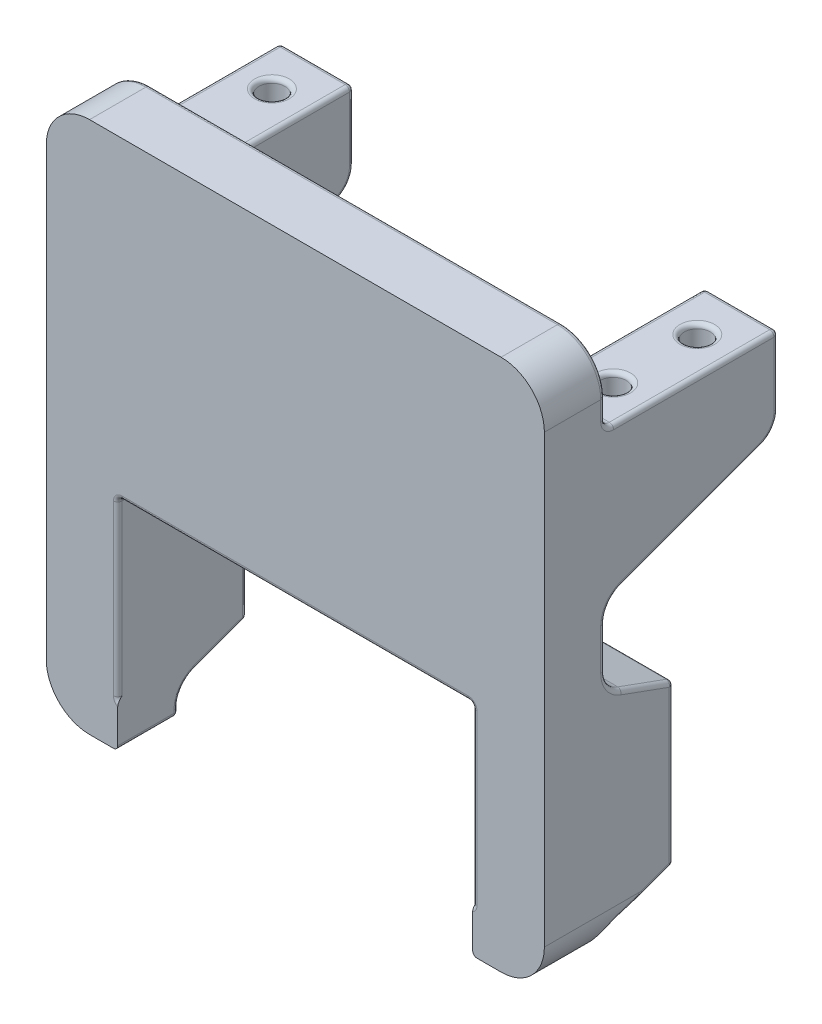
SolidWorks part; units mm, degrees
ref_plane "Front Plane" through (0, 0, 0) normal (0, 0, 1) x (1, 0, 0)
ref_plane "Top Plane" through (0, 0, 0) normal (0, 1, 0) x (1, 0, 0)
ref_plane "Right Plane" through (0, 0, 0) normal (1, 0, 0) x (0, 0, -1)
sketch "Sketch1" plane through (0, 0, 0) normal (0, 0, 1) x (1, 0, 0)
  line L0 (27.25, 20.95) -> (27.25, 16.3938) construction
  line L1 (27.25, 16.3938) -> (-27.25, 16.3938) construction
  line L2 (-27.25, 16.3938) -> (-27.25, 20.95) construction
  line L4 (28.75, 29) -> (-28.75, 29)
  line L5 (28.75, 29) -> (28.75, -32.4715)
  line L6 (28.75, -32.4715) -> (-28.75, -32.4715)
  line L7 (-28.75, 29) -> (-28.75, -32.4715)
  line L8 (-19.75, -27.4715) -> (19.75, -27.4715) construction
  line L9 (20.2215, -27) -> (20.2215, -8) construction
  line L10 (20.4715, -27.7215) -> (-20.5, -27.7215)
  line L11 (20.4715, -27.7215) -> (20.4715, -7.25)
  line L12 (20.4715, -7.25) -> (-20.5, -7.25)
  line L13 (-20.5, -27.7215) -> (-20.5, -7.25)
  line L15 (-19.75, -7.5) -> (19.75, -7.5) construction
  line L16 (-20.25, -27) -> (-20.25, -8) construction
  line L17 (-19.5, 29) -> (7.2839, 29) construction
  line L18 (-27.25, -11.275) -> (-27.25, -9.85) construction
  line L19 (27.25, -14.025) -> (27.25, -20.975) construction
  dimension "D1" = 5
  dimension "D2" = 0.25
  dimension "D3" = 0.25
  dimension "D4" = 0.25
  dimension "D5" = 0.25
  dimension "D6" = 1.5
  dimension "D7" = 1.5
extrude "Boss-Extrude1" add sketch "Sketch1" along normal blind 7
fillet "Fillet1" radius 5 4 edges at (28.75, 29, 3.5) (-28.75, 29, 3.5) (-28.75, -32.4715, 3.5) (28.75, -32.4715, 3.5)
fillet "Fillet2" radius 0.5 4 edges at (-20.5, -7.25, 3.5) (20.4715, -7.25, 3.5) (20.4715, -27.7215, 3.5) (-20.5, -27.7215, 3.5)
sketch "Sketch2" plane through (0, 0, 0) normal (0, 0, -1) x (-1, 0, 0)
  line L0 (-20.4715, -27.2215) -> (-20.4715, -7.75) construction
  line L1 (-20.25, -26.65) -> (-25.75, -26.65) construction
  line L2 (-28.75, -27.4715) -> (-28.75, 24) construction
  line L3 (-20.4715, -26.65) -> (-28.75, -26.65)
  line L4 (-20.4715, -26.65) -> (-20.4715, -8.35)
  line L5 (-20.4715, -8.35) -> (-28.75, -8.35)
  line L6 (-28.75, -26.65) -> (-28.75, -8.35)
  line L7 (20.5, -7.75) -> (20.5, -27.2215) construction
  line L8 (20.5, -8.35) -> (28.75, -8.35)
  line L9 (20.5, -8.35) -> (20.5, -26.65)
  line L10 (20.5, -26.65) -> (28.75, -26.65)
  line L11 (28.75, -8.35) -> (28.75, -26.65)
  line L12 (28.75, 24) -> (28.75, -27.4715) construction
  line L13 (20.25, -8.35) -> (25.75, -8.35) construction
  point P0 (-20.4715, -26.65)
extrude "Boss-Extrude2" add sketch "Sketch2" along normal up to surface (7.9 mm away)
sketch "Sketch3" plane through (0, 0, 0) normal (0, 0, -1) x (-1, 0, 0)
  line L0 (28.75, 24) -> (28.75, -8.35) construction
  line L1 (20.25, 20.75) -> (28.75, 20.75)
  line L2 (20.25, 20.75) -> (20.25, 10.75)
  line L3 (20.25, 10.75) -> (28.75, 10.75)
  line L4 (28.75, 20.75) -> (28.75, 10.75)
  line L5 (-28.75, -8.35) -> (-28.75, 24) construction
  line L6 (-20.25, 20.75) -> (-28.75, 20.75)
  line L7 (-20.25, 20.75) -> (-20.25, 10.75)
  line L8 (-20.25, 10.75) -> (-28.75, 10.75)
  line L9 (-28.75, 20.75) -> (-28.75, 10.75)
  dimension "D1" = 10
  dimension "D2" = 10
extrude "Boss-Extrude3" add sketch "Sketch3" along normal up to surface (20 mm away)
fillet "Fillet3" radius 1 2 edges at (24.5, 20.75, 0) (-24.5, 20.75, 0)
sketch "Sketch4" plane through (0, 0, -7.9) normal (0, 0, -1) x (-1, 0, 0)
  circle A0 centre (24.55, -22.35) radius 1.5
  circle A1 centre (24.55, -12.65) radius 1.5
  circle A2 centre (-24.55, -22.35) radius 1.5
  circle A3 centre (-24.55, -12.65) radius 1.5
extrude "Cut-Extrude1" cut sketch "Sketch4" against normal blind 8
sketch "Sketch5" plane through (0, 20.75, 0) normal (0, 1, 0) x (1, 0, 0)
  circle A0 centre (-24.55, 5.15) radius 1.5
  circle A1 centre (-24.55, 14.85) radius 1.5
  circle A2 centre (24.55, 14.85) radius 1.5
  circle A3 centre (24.55, 5.15) radius 1.5
extrude "Cut-Extrude2" cut sketch "Sketch5" against normal up to surface (10 mm away)
draft "Draft1" type of draft neutral plane draft angle 20 faces to draft 2 parameters "D1"=20
draft "Draft2" type of draft neutral plane draft angle 20 faces to draft 2 parameters "D1"=20
draft "Draft3" type of draft neutral plane draft angle 20 faces to draft 2 parameters "D1"=20
fillet "Fillet4" radius 3 8 edges at (-24.5, 10.75, -20) (24.5, 10.75, -20) (-24.5, 3.4706, 0) (-24.625, -5.4746, 0) (-24.4043, -29.5254, 0) (24.3901, -29.5254, 0) (24.6107, -5.4746, 0) (24.5, 3.4706, 0)
fillet "Fillet5" radius 0.5 90 edges at (-20.3536, -7.3964, 7) (-0.0143, -7.25, 7) (20.3251, -7.3964, 7) (20.4715, -17.4857, 7) (20.3251, -27.5751, 7) (-0.0143, -27.7215, 7) (-20.3536, -27.5751, 7) (28.75, -7.2715, -4.937) (28.75, -5.0947, -0.5425) (28.75, 16.8003, -20) (28.75, 11.1299, -19.4575) (28.75, 7.1103, -10) (28.75, 3.0907, -0.5425) (-28.75, 16.8003, -20) (-28.75, 11.1299, -19.4575) (-28.75, 7.1103, -10) (-28.75, 3.0907, -0.5425) (-28.75, -7.2715, -4.937) (-28.75, -5.0947, -0.5425) (28.75, -27.0607, -6.7715) (28.7044, -28.1454, -3.7916) (28.0388, -30.0418, -0.4524) (-28.75, -27.0607, -6.7715) (-28.7044, -28.1454, -3.7916) (-28.1207, -29.8998, -0.5464) (-28.75, 21.0429, -0.2929) (28.75, 21.0429, -0.2929) (20.25, 21.0429, -0.2929) (-20.5, -5.0947, -0.5425) (-20.5, -7.2715, -4.937) (-20.5, -27.7285, -4.937) (-20.5, -29.9053, -0.5425) (-20.5, -17.4857, 7) (-20.25, 3.0907, -0.5425) (-20.25, 21.0429, -0.2929) (-20.25, 16.8003, -20) (-20.25, 11.1299, -19.4575) (-20.25, 7.1103, -10) (-20.5, -5.562, 0) (-20.3536, -7.3964, 0) (-0.0143, -7.25, 0) (20.3251, -7.3964, 0) (20.4715, -5.562, 0) (28.75, -1.002, 0) (20.25, 11.56, 0) (28.75, 22.875, 0) (27.2855, 27.5355, 0) (0, 29, 0) (-27.2855, 27.5355, 0) (-28.75, 22.875, 0) (-20.25, 11.56, 0) (-28.75, -1.002, 0) (0, -32.4715, 0) (25.2039, -32.2555, 0) (20.4715, -29.4237, 0) (20.3251, -27.5751, 0) (-0.0143, -27.7215, 0) (-20.3536, -27.5751, 0) (-20.5, -29.4237, 0) (-25.2039, -32.2555, 0) (-24.5, 20.75, -20) (-20.25, 20.75, -10.5) (-28.75, 20.75, -10.5) (-24.55, 20.75, -3.65) (-24.55, 20.75, -13.35) (24.5, 20.75, -20) (28.75, 20.75, -10.5) (20.25, 20.75, -10.5) (24.55, 20.75, -13.35) (24.55, 20.75, -3.65) (-20.5, -17.5, -7.9) (-24.625, -8.35, -7.9) (-28.75, -17.5, -7.9) (-24.625, -26.65, -7.9) (-24.55, -20.85, -7.9) (-24.55, -11.15, -7.9) (20.4715, -17.5, -7.9) (24.6107, -26.65, -7.9) (28.75, -17.5, -7.9) (24.6107, -8.35, -7.9) (24.55, -11.15, -7.9) (24.55, -20.85, -7.9) (20.4715, -29.9053, -0.5425) (20.4715, -27.7285, -4.937) (20.4715, -7.2715, -4.937) (20.4715, -5.0947, -0.5425) (20.25, 3.0907, -0.5425) (20.25, 7.1103, -10) (20.25, 11.1299, -19.4575) (20.25, 16.8003, -20)
sketch "Sketch6" plane through (0, 0, 7) normal (0, 0, 1) x (1, 0, 0)
  line L0 (-23.75, -32.4715) -> (23.75, -32.4715) construction
  line L1 (20.4715, -27.2215) -> (-20.5, -27.2215)
  line L2 (20.4715, -27.2215) -> (20.4715, -32.4715)
  line L3 (20.4715, -32.4715) -> (-20.5, -32.4715)
  line L4 (-20.5, -27.2215) -> (-20.5, -32.4715)
extrude "Cut-Extrude3" cut sketch "Sketch6" against normal through all
fillet "Fillet6" radius 0.5 8 edges at (-20.5, -29.5072, -0.3255) (-20.5, -31.3841, 0) (-20.5, -32.3251, 0.1464) (20.4715, -29.4158, -0.3707) (20.4715, -31.3841, 0) (20.4715, -32.3251, 0.1464) (-20.5, -32.4715, 3.75) (20.4715, -32.4715, 3.75)
equation "\"HOLEFORSERVO\"= 3mm"
equation "\"D1@Sketch4\"=\"HOLEFORSERVO\""
equation "\"D2@Sketch4\"=\"HOLEFORSERVO\""
equation "\"D3@Sketch4\"=\"HOLEFORSERVO\""
equation "\"D4@Sketch4\"=\"HOLEFORSERVO\""
equation "\"D1@Sketch5\"=\"HOLEFORSERVO\""
equation "\"D2@Sketch5\"=\"HOLEFORSERVO\""
equation "\"D3@Sketch5\"=\"HOLEFORSERVO\""
equation "\"D4@Sketch5\"=\"HOLEFORSERVO\""
